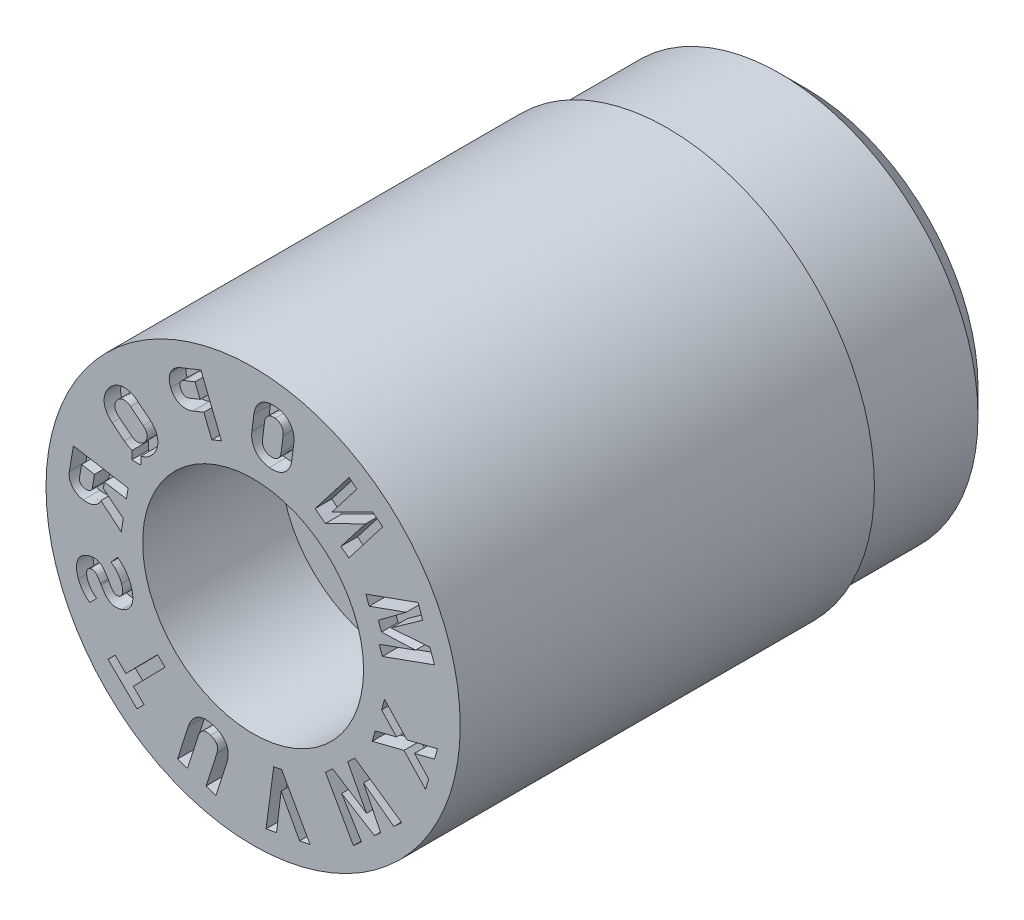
SolidWorks part; units mm, degrees
ref_plane "Front Plane" through (0, 0, 0) normal (0, 0, 1) x (1, 0, 0)
ref_plane "Top Plane" through (0, 0, 0) normal (0, 1, 0) x (1, 0, 0)
ref_plane "Right Plane" through (0, 0, 0) normal (1, 0, 0) x (0, 0, -1)
sketch "Sketch1" plane through (0, 0, 0) normal (1, 0, 0) x (0, 0, -1)
  line L2 (0, 1.5) -> (0, 0.8)
  line L3 (3.75, 1.5) -> (0, 1.5)
  line L4 (-3.7979, 0) -> (49996.2021, 0) construction
  line L8 (4, 0.5) -> (1, 0.5)
  line L9 (1, 0.8) -> (1, 0.5)
  line L10 (1, 0.8) -> (0, 0.8)
  line L12 (4, 0.5) -> (4, 1.25)
  line L16 (4, 1.25) -> (3.75, 1.5)
  dimension "D1" = 4
  dimension "D2" = 45
  dimension "D3" = 0.25
  dimension "D4" = 3
  dimension "D5" = 1.6
  dimension "D6" = 1
  dimension "D7" = 1
revolve "Revolve1" add sketch "Sketch1" angle 360 about L4
sketch "Sketch5" plane through (0, 0, 0) normal (1, 0, 0) x (0, 0, -1)
  line L0 (0, 0) -> (50000, 0) construction
  line L1 (0, 1.5) -> (0, -1.5) construction
  line L2 (3, 1.435) -> (4, 1.435)
  line L3 (3, 1.435) -> (3, 2.435)
  line L4 (3, 2.435) -> (4, 2.435)
  line L5 (4, 1.435) -> (4, 2.435)
  line L6 (4, -1.25) -> (4, 1.25) construction
  line L7 (3.75, 1.5) -> (0, 1.5) construction
  dimension "D1" = 3
  dimension "D2" = 0.065
  dimension "D3" = 1
revolve "Cut-Revolve1" cut sketch "Sketch5" angle 360 about L0
sketch "Sketch12" plane through (0, 0, 0) normal (0, 0, 1) x (1, 0, 0)
  line L0 (1.2285, 0.527) -> (1.1948, 0.6208)
  line L1 (1.1948, 0.6208) -> (0.8169, 0.4848)
  line L2 (0.8169, 0.4848) -> (0.8402, 0.4202)
  line L3 (0.8402, 0.4202) -> (1.1086, 0.5168)
  line L4 (-0.3568, 1.0383) -> (-0.2992, 0.8946)
  line L5 (1.1086, 0.5168) -> (0.9073, 0.3656)
  line L6 (0.9073, 0.3656) -> (0.9299, 0.3028)
  line L7 (0.9299, 0.3028) -> (1.1762, 0.3127)
  line L8 (-1.0771, 0.2409) -> (-0.9176, 0.2145)
  line L9 (1.1762, 0.3127) -> (0.9129, 0.218)
  line L10 (0.9129, 0.218) -> (0.9362, 0.1533)
  line L11 (0.9362, 0.1533) -> (1.3141, 0.2892)
  line L12 (1.3141, 0.2892) -> (1.2803, 0.383)
  line L13 (1.2803, 0.383) -> (0.9997, 0.3634)
  line L14 (0.9997, 0.3634) -> (1.2285, 0.527)
  line L15 (0.9388, 0.9674) -> (0.8655, 1.024)
  line L16 (0.8655, 1.024) -> (0.5723, 0.8782)
  line L18 (0.5723, 0.8782) -> (0.7523, 1.1113)
  line L19 (0.7523, 1.1113) -> (0.6949, 1.1556)
  line L20 (0.6949, 1.1556) -> (0.4494, 0.8375)
  line L21 (0.4494, 0.8375) -> (0.5233, 0.7806)
  line L22 (0.5233, 0.7806) -> (0.8131, 0.9231)
  line L23 (-0.9217, -0.8828) -> (-0.9995, -0.8063)
  line L24 (0.8131, 0.9231) -> (0.636, 0.6936)
  line L25 (0.636, 0.6936) -> (0.6933, 0.6493)
  line L26 (0.6933, 0.6493) -> (0.9388, 0.9674)
  line L27 (0.2804, 1.0566) -> (0.2946, 1.1689)
  line L28 (0.0052, 1.2056) -> (-0.009, 1.0933)
  line L29 (0.0682, 1.0816) -> (0.0828, 1.1977)
  line L30 (0.2175, 1.1806) -> (0.2028, 1.0645)
  line L31 (-0.3837, 1.1055) -> (-0.4642, 1.0732)
  line L32 (-0.5012, 1.1654) -> (-0.4207, 1.1976)
  line L35 (-0.4355, 1.0067) -> (-0.3568, 1.0383)
  line L37 (-0.3779, 1.2928) -> (-0.5264, 1.2334)
  line L38 (-0.4207, 1.1976) -> (-0.3837, 1.1055)
  line L39 (-0.2992, 0.8946) -> (-0.2295, 0.9225)
  line L40 (-0.2295, 0.9225) -> (-0.3779, 1.2928)
  line L42 (-0.8769, 0.5393) -> (-0.8789, 0.479)
  line L43 (-0.8789, 0.479) -> (-0.8138, 0.4779)
  line L44 (-0.8138, 0.4779) -> (-0.812, 0.5354)
  line L45 (-0.7483, 0.7972) -> (-0.8365, 0.8686)
  line L46 (-1.0206, 0.6413) -> (-0.9325, 0.5699)
  line L47 (-0.8818, 0.6294) -> (-0.9729, 0.7034)
  line L48 (-0.8872, 0.809) -> (-0.7961, 0.7351)
  line L49 (-1.149, 0.2529) -> (-1.1645, 0.16)
  line L50 (-1.2576, 0.1754) -> (-1.2422, 0.2684)
  line L52 (-1.3017, 0.355) -> (-1.3306, 0.1814)
  line L53 (-1.0846, 0.1955) -> (-1.0771, 0.2409)
  line L56 (-1.2422, 0.2684) -> (-1.149, 0.2529)
  line L57 (-0.9176, 0.2145) -> (-0.9052, 0.2891)
  line L58 (-0.9052, 0.2891) -> (-1.3017, 0.355)
  line L60 (-1.1026, 0.1112) -> (-0.955, -0.0107)
  line L61 (-0.955, -0.0107) -> (-0.94, 0.0798)
  line L62 (-0.94, 0.0798) -> (-1.0846, 0.1955)
  line L63 (-0.9821, -0.1848) -> (-1.0292, -0.2384)
  line L64 (-0.9728, -0.4236) -> (-0.9731, -0.4237)
  line L65 (-1.0424, -0.3704) -> (-1.0451, -0.365)
  line L66 (-1.1985, -0.281) -> (-1.1988, -0.2811)
  line L67 (-1.1834, -0.5686) -> (-1.1337, -0.5173)
  line L68 (-1.1806, -0.3542) -> (-1.1804, -0.3541)
  line L69 (-0.9497, -0.495) -> (-0.9492, -0.4948)
  line L71 (-0.8679, -0.9357) -> (-0.638, -0.7021)
  line L72 (-0.638, -0.7021) -> (-0.6918, -0.6492)
  line L73 (-0.6918, -0.6492) -> (-0.9217, -0.8828)
  line L74 (-1.0506, -0.8582) -> (-0.8412, -1.0642)
  line L75 (-0.8412, -1.0642) -> (-0.7902, -1.0122)
  line L76 (-0.7902, -1.0122) -> (-0.8679, -0.9357)
  line L77 (-0.9995, -0.8063) -> (-1.0506, -0.8582)
  line L78 (-0.4694, -0.9886) -> (-0.5475, -1.232)
  line L79 (-0.5475, -1.232) -> (-0.4756, -1.2551)
  line L80 (-0.4756, -1.2551) -> (-0.397, -1.0099)
  line L81 (-0.2622, -1.0531) -> (-0.3409, -1.2983)
  line L82 (-0.3409, -1.2983) -> (-0.269, -1.3214)
  line L83 (-0.269, -1.3214) -> (-0.1909, -1.078)
  line L84 (0.0936, -1.3495) -> (0.1697, -1.335)
  line L85 (0.1697, -1.335) -> (0.2031, -1.0572)
  line L86 (0.2031, -1.0572) -> (0.3366, -1.3031)
  line L87 (0.3366, -1.3031) -> (0.4128, -1.2885)
  line L88 (0.4128, -1.2885) -> (0.207, -0.921)
  line L89 (0.207, -0.921) -> (0.1492, -0.932)
  line L90 (0.1492, -0.932) -> (0.0936, -1.3495)
  line L91 (0.879, -0.9991) -> (0.9239, -0.9581)
  line L92 (0.9239, -0.9581) -> (0.7998, -0.7084)
  line L93 (0.7998, -0.7084) -> (1.0187, -0.8715)
  line L94 (1.0187, -0.8715) -> (1.0763, -0.8189)
  line L95 (1.0763, -0.8189) -> (0.7369, -0.5846)
  line L96 (0.7369, -0.5846) -> (0.6842, -0.6327)
  line L97 (0.6842, -0.6327) -> (0.8209, -0.8882)
  line L98 (0.8209, -0.8882) -> (0.5765, -0.7311)
  line L99 (0.5765, -0.7311) -> (0.5238, -0.7792)
  line L100 (0.5238, -0.7792) -> (0.7264, -1.1384)
  line L101 (0.7264, -1.1384) -> (0.784, -1.0859)
  line L102 (0.784, -1.0859) -> (0.6414, -0.853)
  line L103 (0.6414, -0.853) -> (0.879, -0.9991)
  line L105 (1.0926, -0.3578) -> (1.2489, -0.5245)
  line L106 (1.2489, -0.5245) -> (1.2711, -0.448)
  line L107 (1.2711, -0.448) -> (1.1686, -0.3387)
  line L109 (1.1146, -0.2813) -> (0.9523, -0.1078)
  line L110 (0.9523, -0.1078) -> (0.93, -0.1844)
  line L111 (0.93, -0.1844) -> (1.0388, -0.3004)
  line L112 (1.1686, -0.3387) -> (1.3135, -0.3022)
  line L113 (1.3135, -0.3022) -> (1.3358, -0.2257)
  line L114 (1.3358, -0.2257) -> (1.1146, -0.2813)
  line L115 (1.0388, -0.3004) -> (0.885, -0.3391)
  line L116 (0.885, -0.3391) -> (0.8627, -0.4157)
  line L117 (0.8627, -0.4157) -> (1.0926, -0.3578)
  spline S0 degree 3 poles (0.1172, 0.9289) (0.1242, 0.928) (0.1346, 0.9272) (0.1483, 0.9274) (0.1582, 0.9282) (0.1679, 0.9295) (0.1773, 0.9315) (0.1865, 0.9341) (0.1954, 0.9373) (0.204, 0.941) (0.2122, 0.9453) (0.22, 0.9501) (0.2274, 0.9554) (0.2344, 0.9613) (0.2409, 0.9678) (0.2471, 0.9747) (0.2529, 0.9821) (0.2582, 0.99) (0.263, 0.9983) (0.2671, 1.0071) (0.2709, 1.0162) (0.2741, 1.0257) (0.2776, 1.0392) (0.2795, 1.0496) (0.2804, 1.0566) knots 0 0 0 0 0.090141 0.133586 0.176419 0.217906 0.259121 0.299953 0.340423 0.380714 0.420257 0.459018 0.49817 0.537208 0.576361 0.616016 0.656352 0.697093 0.737996 0.77962 0.821582 0.864634 0.908619 1 1 1 1
  spline S1 degree 3 poles (0.2946, 1.1689) (0.2955, 1.176) (0.2963, 1.1865) (0.2961, 1.2004) (0.2954, 1.2104) (0.2941, 1.2202) (0.2922, 1.2297) (0.2897, 1.2389) (0.2865, 1.2479) (0.2828, 1.2565) (0.2785, 1.2648) (0.2738, 1.2727) (0.2685, 1.2801) (0.2627, 1.2871) (0.2563, 1.2937) (0.2494, 1.2999) (0.2421, 1.3057) (0.2342, 1.311) (0.226, 1.3158) (0.2174, 1.32) (0.2083, 1.3238) (0.1989, 1.327) (0.1857, 1.3307) (0.1754, 1.3324) (0.1684, 1.3333) knots 0 0 0 0 0.091604 0.135395 0.178456 0.220276 0.261814 0.302784 0.343553 0.383639 0.423451 0.462707 0.501869 0.540632 0.579678 0.619504 0.659529 0.69995 0.740956 0.781975 0.823601 0.866341 0.909642 1 1 1 1
  spline S2 degree 3 poles (0.1684, 1.3333) (0.1615, 1.3342) (0.151, 1.335) (0.1373, 1.3348) (0.1274, 1.334) (0.1177, 1.3326) (0.1083, 1.3306) (0.0991, 1.328) (0.0902, 1.3248) (0.0816, 1.3211) (0.0734, 1.3168) (0.0657, 1.312) (0.0582, 1.3067) (0.0512, 1.3008) (0.0447, 1.2943) (0.0385, 1.2874) (0.0328, 1.28) (0.0274, 1.2721) (0.0227, 1.2638) (0.0185, 1.2551) (0.0147, 1.246) (0.0115, 1.2365) (0.008, 1.223) (0.0061, 1.2127) (0.0052, 1.2056) knots 0 0 0 0 0.090494 0.133943 0.176451 0.2184 0.259306 0.300143 0.340618 0.380914 0.420462 0.459226 0.498384 0.537426 0.576584 0.616244 0.656585 0.69733 0.738238 0.779594 0.821561 0.864618 0.908608 1 1 1 1
  spline S3 degree 3 poles (-0.009, 1.0933) (-0.0099, 1.0862) (-0.0107, 1.0757) (-0.0105, 1.0618) (-0.0098, 1.0517) (-0.0084, 1.042) (-0.0065, 1.0324) (-0.004, 1.0232) (-0.0008, 1.0142) (0.0028, 1.0056) (0.0071, 0.9974) (0.0118, 0.9894) (0.0173, 0.9821) (0.023, 0.975) (0.0293, 0.9684) (0.0362, 0.9622) (0.0436, 0.9564) (0.0514, 0.9511) (0.0596, 0.9463) (0.0682, 0.9421) (0.0773, 0.9385) (0.0867, 0.9351) (0.1, 0.9315) (0.1103, 0.9298) (0.1172, 0.9289) knots 0 0 0 0 0.091567 0.135341 0.178385 0.220643 0.262165 0.303118 0.343871 0.383941 0.423737 0.462978 0.501901 0.540853 0.579884 0.619694 0.659703 0.700108 0.740762 0.781764 0.823671 0.866046 0.909679 1 1 1 1
  spline S4 degree 3 poles (0.1267, 1.0035) (0.1204, 1.0044) (0.1111, 1.0064) (0.0998, 1.0117) (0.0923, 1.0164) (0.0856, 1.022) (0.08, 1.0286) (0.0753, 1.0359) (0.0717, 1.044) (0.069, 1.0527) (0.0671, 1.0653) (0.0673, 1.075) (0.0682, 1.0816) knots 0 0 0 0 0.175221 0.25737 0.337546 0.416781 0.494514 0.572659 0.652774 0.735917 0.819919 1 1 1 1
  spline S5 degree 3 poles (0.0828, 1.1977) (0.0838, 1.2042) (0.0857, 1.2138) (0.0909, 1.2254) (0.0956, 1.2331) (0.1012, 1.24) (0.1074, 1.246) (0.1146, 1.2509) (0.1224, 1.2547) (0.1308, 1.2576) (0.1431, 1.2596) (0.1526, 1.2595) (0.1589, 1.2587) knots 0 0 0 0 0.179884 0.264189 0.346359 0.427062 0.505097 0.582938 0.661903 0.742387 0.824749 1 1 1 1
  spline S6 degree 3 poles (0.1589, 1.2587) (0.1653, 1.2578) (0.1746, 1.2557) (0.1859, 1.2506) (0.1934, 1.2457) (0.2, 1.2401) (0.2056, 1.2335) (0.2104, 1.2262) (0.2141, 1.2181) (0.2166, 1.2095) (0.2186, 1.1969) (0.2183, 1.1871) (0.2175, 1.1806) knots 0 0 0 0 0.174525 0.257425 0.337851 0.417106 0.494859 0.573567 0.653702 0.735849 0.819872 1 1 1 1
  spline S7 degree 3 poles (0.2028, 1.0645) (0.202, 1.058) (0.1999, 1.0484) (0.1948, 1.0367) (0.1901, 1.029) (0.1846, 1.022) (0.1782, 1.0162) (0.1711, 1.0112) (0.1632, 1.0074) (0.1548, 1.0047) (0.1426, 1.0025) (0.1331, 1.0027) (0.1267, 1.0035) knots 0 0 0 0 0.179795 0.264669 0.346799 0.427462 0.505232 0.583594 0.66252 0.74319 0.824836 1 1 1 1
  spline S8 degree 3 poles (-0.4642, 1.0732) (-0.4682, 1.0714) (-0.4743, 1.0701) (-0.4826, 1.0693) (-0.4885, 1.07) (-0.4943, 1.0713) (-0.4999, 1.0734) (-0.5051, 1.0764) (-0.51, 1.0801) (-0.5145, 1.0847) (-0.5202, 1.0916) (-0.5231, 1.0979) (-0.5249, 1.1021) knots 0 0 0 0 0.169609 0.24938 0.328202 0.406965 0.484723 0.563634 0.645646 0.729895 0.816606 1 1 1 1
  spline S9 degree 3 poles (-0.5249, 1.1021) (-0.5264, 1.1065) (-0.5288, 1.113) (-0.5295, 1.122) (-0.5295, 1.1284) (-0.5286, 1.1346) (-0.527, 1.1404) (-0.5245, 1.1458) (-0.5212, 1.1508) (-0.5173, 1.1554) (-0.5108, 1.1607) (-0.5052, 1.1638) (-0.5012, 1.1654) knots 0 0 0 0 0.184731 0.270933 0.355057 0.436744 0.515048 0.592468 0.670714 0.749311 0.829872 1 1 1 1
  spline S10 degree 3 poles (-0.5264, 1.2334) (-0.5374, 1.2291) (-0.5527, 1.2209) (-0.5706, 1.2068) (-0.5818, 1.1951) (-0.5912, 1.1823) (-0.5985, 1.1685) (-0.6038, 1.1539) (-0.6069, 1.1385) (-0.6079, 1.1225) (-0.6062, 1.1003) (-0.6014, 1.0838) (-0.5972, 1.0731) knots 0 0 0 0 0.17932 0.263185 0.34515 0.425378 0.503841 0.581515 0.66113 0.742192 0.824477 1 1 1 1
  spline S11 degree 3 poles (-0.5972, 1.0731) (-0.593, 1.0624) (-0.585, 1.0473) (-0.5709, 1.03) (-0.5591, 1.0192) (-0.5462, 1.0103) (-0.5324, 1.0034) (-0.5176, 0.9985) (-0.502, 0.9958) (-0.4858, 0.9952) (-0.4632, 0.9975) (-0.4465, 1.0023) (-0.4355, 1.0067) knots 0 0 0 0 0.175543 0.258187 0.339121 0.418228 0.496173 0.574175 0.654435 0.736436 0.820193 1 1 1 1
  spline S12 degree 3 poles (-0.7257, 0.5907) (-0.7212, 0.5961) (-0.7152, 0.6047) (-0.708, 0.6164) (-0.7034, 0.6253) (-0.6995, 0.6342) (-0.6962, 0.6433) (-0.6936, 0.6525) (-0.6915, 0.6618) (-0.6903, 0.6711) (-0.6895, 0.6803) (-0.6896, 0.6895) (-0.6902, 0.6986) (-0.6916, 0.7076) (-0.6935, 0.7166) (-0.6962, 0.7255) (-0.6995, 0.7344) (-0.7034, 0.7431) (-0.708, 0.7515) (-0.7132, 0.7597) (-0.719, 0.7677) (-0.7254, 0.7755) (-0.7349, 0.7857) (-0.7428, 0.7927) (-0.7483, 0.7972) knots 0 0 0 0 0.090294 0.133664 0.176476 0.218139 0.259119 0.300095 0.340623 0.380616 0.420182 0.459323 0.497989 0.537074 0.576433 0.615914 0.656403 0.697052 0.738053 0.779714 0.821656 0.864806 0.908709 1 1 1 1
  spline S13 degree 3 poles (-0.8365, 0.8686) (-0.842, 0.8731) (-0.8506, 0.8793) (-0.8625, 0.8865) (-0.8714, 0.8913) (-0.8804, 0.8953) (-0.8896, 0.8986) (-0.8988, 0.9013) (-0.9081, 0.9034) (-0.9174, 0.9048) (-0.9267, 0.9056) (-0.9359, 0.9056) (-0.945, 0.9051) (-0.9541, 0.9038) (-0.9631, 0.9019) (-0.9719, 0.8993) (-0.9808, 0.8961) (-0.9894, 0.8923) (-0.9978, 0.8877) (-1.0061, 0.8827) (-1.014, 0.8769) (-1.0217, 0.8706) (-1.0318, 0.8612) (-1.0388, 0.8535) (-1.0432, 0.8479) knots 0 0 0 0 0.091503 0.135354 0.178375 0.220513 0.261961 0.302783 0.343761 0.383863 0.42385 0.463053 0.501758 0.540855 0.579853 0.619297 0.659381 0.699945 0.740601 0.781683 0.823613 0.866282 0.909695 1 1 1 1
  spline S14 degree 3 poles (-1.0432, 0.8479) (-1.0476, 0.8424) (-1.0539, 0.834) (-1.0609, 0.8222) (-1.0656, 0.8133) (-1.0694, 0.8043) (-1.0728, 0.7953) (-1.0755, 0.7861) (-1.0774, 0.7768) (-1.0788, 0.7676) (-1.0794, 0.7583) (-1.0795, 0.7491) (-1.0788, 0.74) (-1.0775, 0.731) (-1.0755, 0.722) (-1.0727, 0.7131) (-1.0695, 0.7042) (-1.0655, 0.6956) (-1.061, 0.6871) (-1.0557, 0.6789) (-1.05, 0.6708) (-1.0435, 0.6631) (-1.0341, 0.6528) (-1.0261, 0.6459) (-1.0206, 0.6413) knots 0 0 0 0 0.09049 0.134095 0.176397 0.218324 0.259469 0.300119 0.340486 0.38058 0.420031 0.459226 0.49822 0.537287 0.57628 0.616119 0.656245 0.696875 0.738191 0.779508 0.821748 0.86457 0.908751 1 1 1 1
  spline S15 degree 3 poles (-0.9325, 0.5699) (-0.9269, 0.5654) (-0.9184, 0.5592) (-0.9064, 0.552) (-0.8976, 0.5473) (-0.8885, 0.5434) (-0.8816, 0.5408) (-0.8777, 0.5395) (-0.8769, 0.5393) knots 0 0 0 0 0.091498 0.135346 0.178366 0.220298 0.261929 0.272556 0.272556 0.272556 0.272556
  spline S16 degree 3 poles (-0.7844, 0.6382) (-0.7885, 0.6332) (-0.795, 0.6263) (-0.8055, 0.6196) (-0.8134, 0.6157) (-0.8217, 0.613) (-0.8303, 0.6115) (-0.839, 0.6115) (-0.8478, 0.6127) (-0.8567, 0.6149) (-0.8684, 0.62) (-0.8767, 0.6252) (-0.8818, 0.6294) knots 0 0 0 0 0.175334 0.257081 0.33711 0.415953 0.494463 0.572234 0.652957 0.735673 0.820225 1 1 1 1
  spline S17 degree 3 poles (-0.9729, 0.7034) (-0.978, 0.7076) (-0.9851, 0.7143) (-0.9922, 0.7249) (-0.9964, 0.733) (-0.9994, 0.7414) (-1.001, 0.7499) (-1.0014, 0.7586) (-1.0006, 0.7673) (-0.9985, 0.7759) (-0.9939, 0.7875) (-0.9886, 0.7954) (-0.9846, 0.8005) knots 0 0 0 0 0.180082 0.264057 0.34682 0.42742 0.505145 0.583137 0.662256 0.742696 0.824392 1 1 1 1
  spline S18 degree 3 poles (-0.9846, 0.8005) (-0.9806, 0.8055) (-0.9738, 0.8122) (-0.9635, 0.8191) (-0.9555, 0.823) (-0.9471, 0.8256) (-0.9386, 0.827) (-0.9298, 0.8271) (-0.921, 0.826) (-0.9122, 0.8235) (-0.9005, 0.8185) (-0.8923, 0.8133) (-0.8872, 0.809) knots 0 0 0 0 0.175041 0.257091 0.33787 0.416671 0.494472 0.572999 0.653754 0.736177 0.820154 1 1 1 1
  spline S19 degree 3 poles (-0.7961, 0.7351) (-0.791, 0.7309) (-0.784, 0.7241) (-0.7767, 0.7136) (-0.7725, 0.7055) (-0.7696, 0.6972) (-0.7678, 0.6887) (-0.7675, 0.68) (-0.7683, 0.6713) (-0.7705, 0.6627) (-0.775, 0.6511) (-0.7803, 0.6432) (-0.7844, 0.6382) knots 0 0 0 0 0.180209 0.264527 0.346633 0.427289 0.505058 0.583106 0.661573 0.742393 0.824766 1 1 1 1
  spline S20 degree 3 poles (-1.1645, 0.16) (-1.165, 0.1563) (-1.1667, 0.1511) (-1.1702, 0.1447) (-1.1735, 0.1407) (-1.1773, 0.137) (-1.1818, 0.134) (-1.1867, 0.1316) (-1.1922, 0.1298) (-1.1981, 0.1286) (-1.2066, 0.1279) (-1.2131, 0.1285) (-1.2175, 0.1291) knots 0 0 0 0 0.16022 0.237258 0.312866 0.389074 0.465976 0.546288 0.629106 0.715546 0.806121 1 1 1 1
  spline S21 degree 3 poles (-1.2175, 0.1291) (-1.2219, 0.1298) (-1.2283, 0.1313) (-1.236, 0.1348) (-1.2412, 0.1378) (-1.2458, 0.1412) (-1.2498, 0.1451) (-1.253, 0.1494) (-1.2555, 0.154) (-1.2572, 0.159) (-1.2585, 0.1662) (-1.2582, 0.1717) (-1.2576, 0.1754) knots 0 0 0 0 0.192145 0.282321 0.368983 0.452304 0.531041 0.608383 0.684451 0.761032 0.836658 1 1 1 1
  spline S22 degree 3 poles (-1.3306, 0.1814) (-1.3324, 0.1711) (-1.3333, 0.1555) (-1.3301, 0.1354) (-1.3258, 0.1214) (-1.3196, 0.1083) (-1.3115, 0.0963) (-1.3019, 0.0854) (-1.2903, 0.0758) (-1.2774, 0.0675) (-1.2577, 0.0582) (-1.2414, 0.0541) (-1.2303, 0.0522) knots 0 0 0 0 0.170483 0.2511 0.330373 0.40866 0.486686 0.565007 0.646171 0.729618 0.815632 1 1 1 1
  spline S23 degree 3 poles (-1.2303, 0.0522) (-1.2191, 0.0503) (-1.2024, 0.0491) (-1.1808, 0.0514) (-1.1658, 0.0551) (-1.1518, 0.0605) (-1.139, 0.0676) (-1.1275, 0.0765) (-1.1175, 0.0869) (-1.109, 0.0985) (-1.1045, 0.107) (-1.1026, 0.1112) knots 0 0 0 0 0.18464 0.270775 0.354394 0.435442 0.51411 0.5917 0.670508 0.749754 0.825376 0.825376 0.825376 0.825376
  spline S24 degree 3 poles (-0.8853, -0.3105) (-0.8885, -0.3016) (-0.8937, -0.2884) (-0.9023, -0.2717) (-0.9093, -0.2595) (-0.9167, -0.2478) (-0.9248, -0.2368) (-0.9333, -0.2263) (-0.9423, -0.2165) (-0.9517, -0.2074) (-0.9646, -0.1963) (-0.9749, -0.1891) (-0.9821, -0.1848) knots 0 0 0 0 0.175626 0.262608 0.349361 0.435017 0.51928 0.602945 0.685282 0.766048 0.845523 1 1 1 1
  spline S25 degree 3 poles (-1.0292, -0.2384) (-1.0206, -0.2437) (-1.0083, -0.2527) (-0.9938, -0.2671) (-0.9836, -0.279) (-0.9743, -0.2919) (-0.9632, -0.3099) (-0.9569, -0.3245) (-0.9533, -0.3344) knots 0 0 0 0 0.242041 0.365137 0.491374 0.619025 0.745606 1 1 1 1
  spline S26 degree 3 poles (-0.9533, -0.3344) (-0.9514, -0.3399) (-0.9489, -0.348) (-0.9466, -0.3588) (-0.9453, -0.3663) (-0.9447, -0.3734) (-0.9446, -0.3801) (-0.945, -0.3865) (-0.946, -0.3926) (-0.9476, -0.3982) (-0.9496, -0.4034) (-0.9521, -0.4081) (-0.9553, -0.4122) (-0.9589, -0.4158) (-0.9645, -0.4202) (-0.9695, -0.4224) (-0.9728, -0.4236) knots 0 0 0 0 0.170232 0.248641 0.322876 0.391838 0.457682 0.520836 0.580666 0.637735 0.690915 0.742717 0.792778 0.842503 0.893513 1 1 1 1
  spline S27 degree 3 poles (-0.9731, -0.4237) (-0.9776, -0.4254) (-0.9847, -0.4268) (-0.9939, -0.4258) (-1.0001, -0.4237) (-1.0059, -0.4205) (-1.0113, -0.4164) (-1.0164, -0.4115) (-1.0211, -0.4057) (-1.0257, -0.3989) (-1.0325, -0.388) (-1.0374, -0.3792) (-1.0408, -0.3731) knots 0 0 0 0 0.155363 0.225561 0.29489 0.364758 0.436569 0.511207 0.590458 0.676886 0.774209 1 1 1 1
  spline S28 degree 3 poles (-1.0408, -0.3731) (-1.0411, -0.3726) (-1.0416, -0.3717) (-1.042, -0.3708) (-1.0424, -0.3704) knots 0 0 0 0 0.513637 1 1 1 1
  spline S29 degree 3 poles (-1.0451, -0.365) (-1.051, -0.354) (-1.0599, -0.3384) (-1.0728, -0.3194) (-1.0818, -0.3074) (-1.0914, -0.2968) (-1.1025, -0.2883) (-1.1149, -0.2811) (-1.1262, -0.2765) (-1.136, -0.2738) (-1.1438, -0.2726) (-1.1519, -0.2721) (-1.1605, -0.2724) (-1.1695, -0.2735) (-1.1823, -0.2759) (-1.192, -0.2787) (-1.1985, -0.281) knots 0 0 0 0 0.190604 0.273715 0.349133 0.419758 0.490392 0.562393 0.637308 0.675833 0.716013 0.757364 0.800527 0.846499 0.894866 1 1 1 1
  spline S30 degree 3 poles (-1.1988, -0.2811) (-1.2047, -0.2831) (-1.2132, -0.2867) (-1.2239, -0.2924) (-1.2312, -0.2971) (-1.2381, -0.3021) (-1.2446, -0.3074) (-1.2504, -0.3133) (-1.2557, -0.3194) (-1.2605, -0.326) (-1.2648, -0.3329) (-1.2684, -0.3401) (-1.2716, -0.3477) (-1.2742, -0.3556) (-1.2761, -0.3638) (-1.2777, -0.3723) (-1.2786, -0.3812) (-1.2791, -0.3903) (-1.2788, -0.3997) (-1.278, -0.4094) (-1.2766, -0.4192) (-1.2747, -0.4294) (-1.2714, -0.4435) (-1.2681, -0.4542) (-1.2656, -0.4612) knots 0 0 0 0 0.086088 0.126797 0.166691 0.205629 0.243782 0.281776 0.319039 0.356233 0.393137 0.430464 0.467951 0.505812 0.544484 0.584238 0.624961 0.666826 0.710058 0.754244 0.800037 0.847225 0.896569 1 1 1 1
  spline S31 degree 3 poles (-1.2656, -0.4612) (-1.2631, -0.4681) (-1.2589, -0.4782) (-1.2521, -0.4913) (-1.2445, -0.5044) (-1.2336, -0.5203) (-1.2135, -0.544) (-1.196, -0.5594) (-1.1834, -0.5686) knots 0 0 0 0 0.158441 0.239688 0.322655 0.490732 0.659585 1 1 1 1
  spline S32 degree 3 poles (-1.1337, -0.5173) (-1.1412, -0.5119) (-1.1517, -0.5031) (-1.1646, -0.4903) (-1.1732, -0.4801) (-1.181, -0.4697) (-1.1898, -0.4558) (-1.1948, -0.4447) (-1.1975, -0.4373) knots 0 0 0 0 0.265538 0.395808 0.524667 0.650413 0.771402 1 1 1 1
  spline S33 degree 3 poles (-1.1975, -0.4373) (-1.1992, -0.4321) (-1.2018, -0.4245) (-1.2039, -0.4144) (-1.2051, -0.4074) (-1.2057, -0.4007) (-1.2059, -0.3944) (-1.2055, -0.3884) (-1.2047, -0.3828) (-1.2034, -0.3776) (-1.2015, -0.3729) (-1.1993, -0.3685) (-1.1965, -0.3647) (-1.1932, -0.3613) (-1.1881, -0.3574) (-1.1837, -0.3553) (-1.1806, -0.3542) knots 0 0 0 0 0.173308 0.252156 0.327256 0.397385 0.464298 0.52701 0.586658 0.643251 0.696802 0.748412 0.797442 0.846833 0.895863 1 1 1 1
  spline S34 degree 3 poles (-1.1804, -0.3541) (-1.1754, -0.3524) (-1.1678, -0.3507) (-1.1578, -0.3518) (-1.1511, -0.3542) (-1.1449, -0.3577) (-1.1391, -0.3618) (-1.1339, -0.3668) (-1.129, -0.3728) (-1.124, -0.3797) (-1.1161, -0.3914) (-1.1103, -0.4011) (-1.1062, -0.408) knots 0 0 0 0 0.156496 0.226661 0.296267 0.366079 0.436336 0.507184 0.581419 0.664607 0.761747 1 1 1 1
  spline S35 degree 3 poles (-1.1062, -0.408) (-1.1057, -0.4086) (-1.1052, -0.41) (-1.1043, -0.4113) (-1.104, -0.4119) knots 0 0 0 0 0.501723 1 1 1 1
  spline S36 degree 3 poles (-1.104, -0.4119) (-1.1035, -0.4129) (-1.1023, -0.4147) (-1.1011, -0.4165) (-1.1006, -0.4174) knots 0 0 0 0 0.506212 1 1 1 1
  spline S37 degree 3 poles (-1.1006, -0.4174) (-1.0945, -0.4278) (-1.0853, -0.4424) (-1.0722, -0.46) (-1.0629, -0.4713) (-1.0529, -0.4811) (-1.0418, -0.4891) (-1.0295, -0.4956) (-1.0184, -0.4997) (-1.009, -0.5021) (-1.0014, -0.5031) (-0.9936, -0.5035) (-0.9854, -0.5031) (-0.9769, -0.5021) (-0.9648, -0.4999) (-0.9558, -0.497) (-0.9497, -0.495) knots 0 0 0 0 0.189955 0.273216 0.349543 0.421679 0.493634 0.566433 0.641848 0.680908 0.720557 0.762088 0.804942 0.850275 0.897724 1 1 1 1
  spline S38 degree 3 poles (-0.9492, -0.4948) (-0.9434, -0.4927) (-0.935, -0.4893) (-0.9245, -0.4835) (-0.9172, -0.479) (-0.9105, -0.4738) (-0.9042, -0.4684) (-0.8986, -0.4624) (-0.8933, -0.4562) (-0.8887, -0.4495) (-0.8845, -0.4425) (-0.8809, -0.4351) (-0.8778, -0.4274) (-0.8755, -0.4193) (-0.8734, -0.4109) (-0.8721, -0.4021) (-0.8713, -0.393) (-0.871, -0.3836) (-0.8714, -0.3739) (-0.8722, -0.3639) (-0.8737, -0.3537) (-0.8757, -0.3432) (-0.8793, -0.3287) (-0.8827, -0.3178) (-0.8853, -0.3105) knots 0 0 0 0 0.083658 0.123751 0.162374 0.20039 0.23805 0.274888 0.311788 0.348681 0.385341 0.422473 0.459814 0.498291 0.537184 0.57714 0.618626 0.661283 0.705039 0.749959 0.79678 0.844806 0.89482 1 1 1 1
  spline S39 degree 3 poles (-0.2849, -0.8914) (-0.292, -0.8892) (-0.3026, -0.8862) (-0.3168, -0.8837) (-0.3269, -0.8824) (-0.3369, -0.8817) (-0.3467, -0.8818) (-0.3562, -0.8825) (-0.3655, -0.8838) (-0.3745, -0.8858) (-0.3832, -0.8883) (-0.3915, -0.8917) (-0.3996, -0.8954) (-0.4073, -0.9) (-0.4148, -0.9051) (-0.4219, -0.9108) (-0.4286, -0.9172) (-0.4351, -0.9241) (-0.4412, -0.9317) (-0.4468, -0.9398) (-0.4522, -0.9484) (-0.457, -0.9577) (-0.4632, -0.9709) (-0.4671, -0.9814) (-0.4694, -0.9886) knots 0 0 0 0 0.094295 0.138719 0.182077 0.224219 0.265323 0.30558 0.344954 0.383879 0.421822 0.459565 0.496945 0.534626 0.572674 0.610859 0.65008 0.689931 0.73055 0.77213 0.814827 0.858856 0.904282 1 1 1 1
  spline S40 degree 3 poles (-0.397, -1.0099) (-0.3954, -1.0047) (-0.3924, -0.9973) (-0.3874, -0.9882) (-0.3835, -0.9821) (-0.3789, -0.9768) (-0.374, -0.972) (-0.3688, -0.9679) (-0.3631, -0.9645) (-0.3572, -0.9617) (-0.3509, -0.9597) (-0.3443, -0.9584) (-0.3374, -0.9576) (-0.3304, -0.9578) (-0.3203, -0.9589) (-0.3127, -0.9609) (-0.3077, -0.9624) knots 0 0 0 0 0.142255 0.207914 0.27031 0.330747 0.38982 0.447446 0.504578 0.56171 0.618969 0.677129 0.736392 0.797523 0.861603 1 1 1 1
  spline S41 degree 3 poles (-0.3077, -0.9624) (-0.3026, -0.9641) (-0.2953, -0.9669) (-0.2865, -0.9719) (-0.2806, -0.976) (-0.2753, -0.9804) (-0.2708, -0.9854) (-0.2668, -0.9907) (-0.2635, -0.9965) (-0.2608, -1.0026) (-0.259, -1.009) (-0.2576, -1.0157) (-0.2573, -1.0226) (-0.2574, -1.0299) (-0.2585, -1.0402) (-0.2606, -1.0479) (-0.2622, -1.0531) knots 0 0 0 0 0.138948 0.202877 0.264373 0.32395 0.381756 0.438976 0.496536 0.554234 0.611637 0.670131 0.730404 0.792942 0.858435 1 1 1 1
  spline S42 degree 3 poles (-0.1909, -1.078) (-0.1886, -1.0708) (-0.1857, -1.06) (-0.1829, -1.0456) (-0.1816, -1.0352) (-0.1809, -1.0251) (-0.1807, -1.0152) (-0.1814, -1.0055) (-0.1826, -0.9961) (-0.1844, -0.987) (-0.187, -0.9782) (-0.19, -0.9696) (-0.1937, -0.9615) (-0.1981, -0.9536) (-0.2031, -0.9462) (-0.2086, -0.939) (-0.2149, -0.9322) (-0.2216, -0.9256) (-0.229, -0.9196) (-0.2369, -0.9138) (-0.2454, -0.9085) (-0.2545, -0.9037) (-0.2675, -0.8975) (-0.2778, -0.8937) (-0.2849, -0.8914) knots 0 0 0 0 0.095573 0.140867 0.18493 0.227595 0.269284 0.310012 0.34983 0.388912 0.427495 0.465473 0.503139 0.540743 0.578534 0.616527 0.655494 0.695043 0.735283 0.776117 0.81839 0.861631 0.906255 1 1 1 1
  spline S43 degree 3 poles (-0.812, 0.5354) (-0.81, 0.5358) (-0.8049, 0.5369) (-0.797, 0.5393) (-0.7882, 0.5425) (-0.7795, 0.5464) (-0.7711, 0.5508) (-0.7629, 0.556) (-0.7549, 0.5617) (-0.7472, 0.568) (-0.7371, 0.5774) (-0.7302, 0.5852) (-0.7257, 0.5907) knots 0.553285 0.553285 0.553285 0.553285 0.579771 0.619239 0.659321 0.699883 0.740439 0.781639 0.823426 0.866093 0.909504 1 1 1 1
extrude "Cut-Extrude2" cut sketch "Sketch12" against normal blind 0.12 contours L116 L117 L105 L106 L107 L112 L113 L114 L109 L110 L111 L115 | L13 L14 L0 L1 L2 L3 L5 L6 L7 L9 L10 L11 L12 | L25 L26 L15 L16 L18 L19 L20 L21 L22 L24 | L28 S3 S0 L27 S1 S2 L30 S7 S4 L29 S5 S6 | S10 S11 L35 L4 L39 L40 L37 S8 S9 L32 L38 L31 | L44 S43 S12 L45 S13 S14 L46 S15 L42 L43 L48 S19 S16 L47 S17 S18 | S22 S23 L60 L61 L62 L53 L8 L57 L58 L52 S20 S21 L50 L56 L49 | L69 S38 S24 L63 S25 S26 L64 S27 S28 L65 S29 L66 S30 S31 L67 S32 S33 L68 S34 S35 S36 S37 | L23 L77 L74 L75 L76 L71 L72 L73 | L83 S42 S39 L78 L79 L80 S40 S41 L81 L82 | L89 L90 L84 L85 L86 L87 L88 | L102 L103 L91 L92 L93 L94 L95 L96 L97 L98 L99 L100 L101
